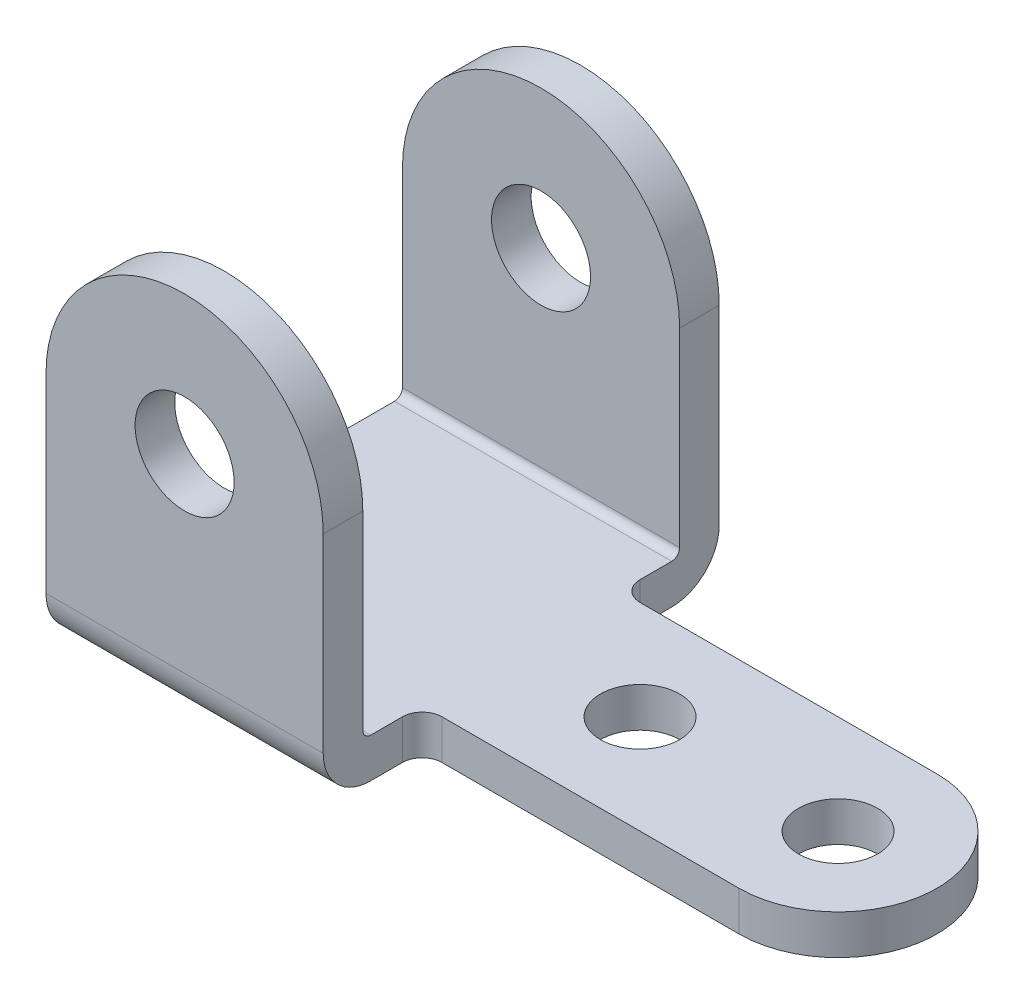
SolidWorks part; units mm, degrees
ref_plane "Front" through (0, 0, 0) normal (0, 0, 1) x (1, 0, 0)
ref_plane "Top" through (0, 0, 0) normal (0, 1, 0) x (1, 0, 0)
ref_plane "Right" through (0, 0, 0) normal (1, 0, 0) x (0, 0, -1)
sketch "Sketch4" plane through (0, 0, 0) normal (0, 0, 1) x (1, 0, 0)
  line L0 (-35, 0) -> (-35, -60)
  line L1 (-35, -60) -> (35, -60)
  line L2 (35, -60) -> (35, 0)
  arc A0 (35, 0) -> (-35, 0) centre (0, 0) ccw
  dimension "D1" = 35
  dimension "D2" = 60
extrude "\"U\" shape" add sketch "Sketch4" along normal blind 100
fillet "Fillet" radius 12 2 edges at (0, -60, 100) (0, -60, 0)
shell "Thickness" thickness 10
sketch "Sketch8" plane through (0, 0, 100) normal (0, 0, 1) x (1, 0, 0)
  circle A0 centre (0, 0) radius 12.5
  dimension "D1" = 25
extrude "Inner Hole" cut sketch "Sketch8" against normal through all
sketch "Sketch7" plane through (0, -60, 0) normal (0, -1, 0) x (1, 0, 0)
  line L0 (-35, 50) -> (189.435, 50) construction
  line L1 (35, 25) -> (115, 25)
  line L2 (35, 75) -> (115, 75)
  line L3 (35, 25) -> (35, 75)
  line L4 (35, 88) -> (35, 12) construction
  line L5 (-35, 88) -> (-35, 12) construction
  arc A0 (115, 25) -> (115, 75) centre (115, 50) ccw
  dimension "D2" = 25
  dimension "D1" = 80
extrude "Tongue" add sketch "Sketch7" against normal up to surface (10 mm away)
sketch "Sketch9" plane through (0, -60, 0) normal (0, -1, 0) x (1, 0, 0)
  line L0 (-35, 50) -> (169.8623, 50) construction
  line L1 (-35, 88) -> (-35, 12) construction
  circle A0 centre (65, 50) radius 10
  circle A2 centre (115, 50) radius 10
  dimension "D1" = 20
  dimension "D2" = 50
extrude "Mounting Holes" cut sketch "Sketch9" against normal through all
fillet "Fillet1" radius 5 2 edges at (35, -55, 25) (35, -55, 75)
ref_plane "Plane1" through (0, 0, 50) normal (0, 0, 1) x (1, 0, 0)
